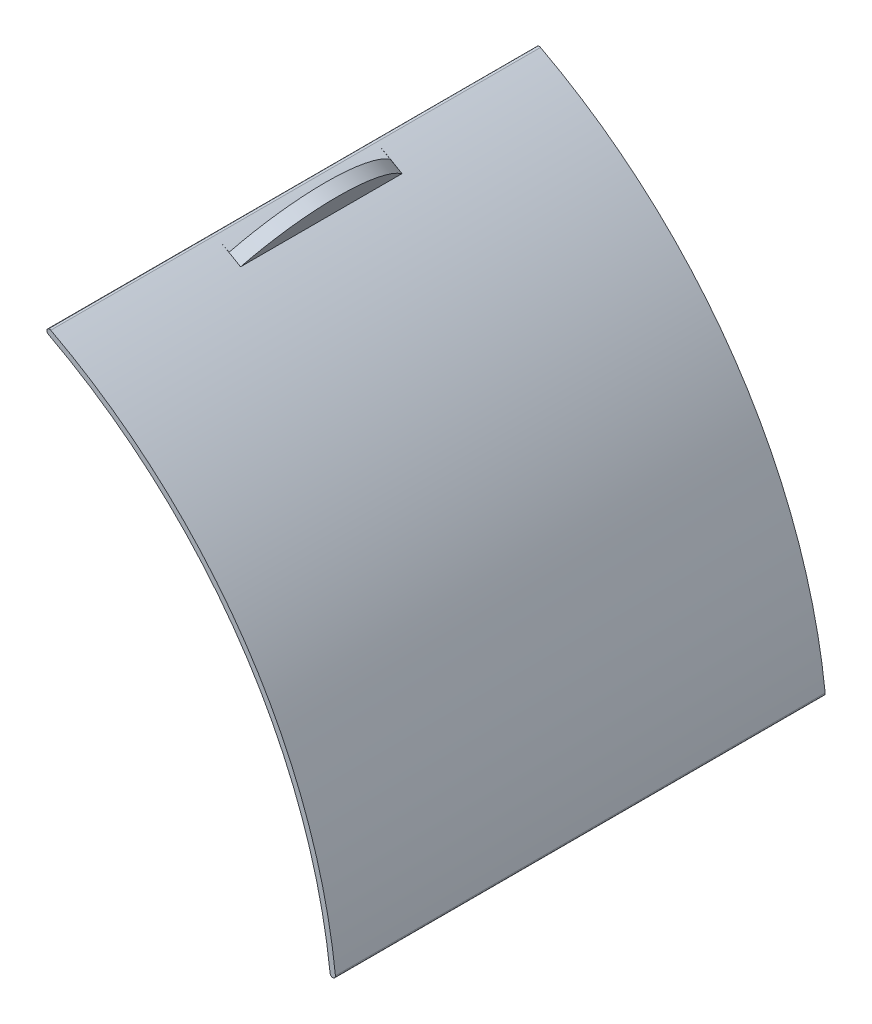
SolidWorks part; units mm, degrees
ref_plane "Plan de face" through (0, 0, 0) normal (0, 0, 1) x (1, 0, 0)
ref_plane "Plan de dessus" through (0, 0, 0) normal (0, 1, 0) x (1, 0, 0)
ref_plane "Plan de droite" through (0, 0, 0) normal (1, 0, 0) x (0, 0, -1)
sketch "Esquisse1" plane through (0, 0, 0) normal (0, 0, 1) x (1, 0, 0)
  arc A1 (99.3811, 11.1086) -> (46.4825, 88.5403) centre (0, 0) ccw
  arc A2 (98.3873, 10.9975) -> (46.0176, 87.6549) centre (0, 0) ccw
  arc A3 (46.4825, 88.5403) -> (46.0176, 87.6549) centre (46.25, 88.0976) ccw
  arc A11 (98.3873, 10.9975) -> (99.3811, 11.1086) centre (98.8842, 11.0531) ccw
  dimension "D2" = 100
  dimension "D3" = 99
  dimension "D1" = 0.5
  dimension "D4" = 0.5
  dimension "D5" = 52.6341
  dimension "D6" = 77.0445
extrude "Extrusion1" add sketch "Esquisse1" along normal up to surface (91 mm away)
ref_plane "Plan1" through (0, 0, 45.5) normal (0, 0, 1) x (1, 0, 0)
sketch "Esquisse2" plane through (0, 0, 45.5) normal (0, 0, 1) x (1, 0, 0)
  line L0 (49.0874, 87.1231) -> (52.0326, 92.3505)
  line L1 (51.2501, 85.8687) -> (54.2107, 91.1233)
  line L2 (52.0326, 92.3505) -> (54.2107, 91.1233)
  arc A0 (99.3811, 11.1086) -> (46.4825, 88.5403) centre (0, 0) ccw construction
  arc A1 (51.2501, 85.8687) -> (49.0874, 87.1231) centre (0, 0) ccw
  arc A2 (46.4825, 88.5403) -> (46.0176, 87.6549) centre (46.25, 88.0976) ccw construction
  dimension "D1" = 3
  dimension "D2" = 2.5
  dimension "D3" = 6
extrude "Extrusion2" add sketch "Esquisse2" along normal mid plane 30
sketch "Esquisse3" plane through (2.1781, -1.2272, 0) normal (0.8712, -0.4909, 0) x (0.4909, 0.8712, 0)
  line L0 (99.9687, 60.5) -> (106, 60.5) construction
  line L1 (99.9687, 30.5) -> (106, 30.5) construction
  line L3 (99.9687, 30.5) -> (106.9687, 30.5)
  line L4 (106.9687, 60.5) -> (106.9687, 30.5)
  line L5 (99.9687, 60.5) -> (106.9687, 60.5)
  line L7 (106, 60.5) -> (106, 30.5) construction
  arc A0 (99.9687, 60.5) -> (99.9687, 30.5) centre (84.3315, 45.5) cw
  dimension "D2" = 7
extrude "Enlèv. mat.-Extru.1" cut sketch "Esquisse3" against normal up to next
ref_plane "Plan2" through (0, 0, 5) normal (0, 0, 1) x (1, 0, 0)
sketch "Esquisse4" plane through (0, 0, 5) normal (0, 0, 1) x (1, 0, 0)
  line L4 (98.0088, 13.9739) -> (95.0389, 13.5505)
  line L5 (47.8616, 86.6618) -> (46.4113, 84.0357)
  arc A1 (98.0088, 13.9739) -> (47.8616, 86.6618) centre (0, 0) ccw
  arc A4 (95.0389, 13.5505) -> (46.4113, 84.0357) centre (0, 0) ccw
  arc A5 (98.3873, 10.9975) -> (46.0176, 87.6549) centre (0, 0) ccw construction
  dimension "D1" = 99
  dimension "D2" = 96
  dimension "D4" = 3
extrude "Extrusion3" add sketch "Esquisse4" along normal blind 7
mirror "Symétrie1" about plane through (0, 0, 45.5) normal (0, 0, 1) of "Extrusion3"
sketch "Esquisse5" plane through (0, 0, 79) normal (0, 0, -1) x (-1, 0, 0)
  line L0 (-47.8616, 86.6618) -> (-46.4113, 84.0357) construction
  line L1 (-47.8616, 86.6618) -> (-46.4113, 84.0357)
  line L2 (-95.0389, 13.5505) -> (-98.0088, 13.9739) construction
  line L3 (-95.0389, 13.5505) -> (-98.0088, 13.9739)
  line L4 (-56.7709, 81.1053) -> (-54.9013, 78.7518)
  line L5 (-94.5108, 29.4739) -> (-91.6563, 28.5505)
  arc A0 (-46.4113, 84.0357) -> (-95.0389, 13.5505) centre (0, 0) ccw construction
  arc A1 (-46.4113, 84.0357) -> (-54.9013, 78.7518) centre (0, 0) ccw
  arc A2 (-47.8616, 86.6618) -> (-98.0088, 13.9739) centre (0, 0) ccw construction
  arc A3 (-47.8616, 86.6618) -> (-56.7709, 81.1053) centre (0, 0) ccw
  arc A4 (-94.5108, 29.4739) -> (-98.0088, 13.9739) centre (0, 0) ccw
  arc A5 (-91.6563, 28.5505) -> (-95.0389, 13.5505) centre (0, 0) ccw
  dimension "D1" = 10
  dimension "D2" = 10.5
  dimension "D3" = 15
  dimension "D4" = 15.5
extrude "Extrusion4" add sketch "Esquisse5" along normal up to next
